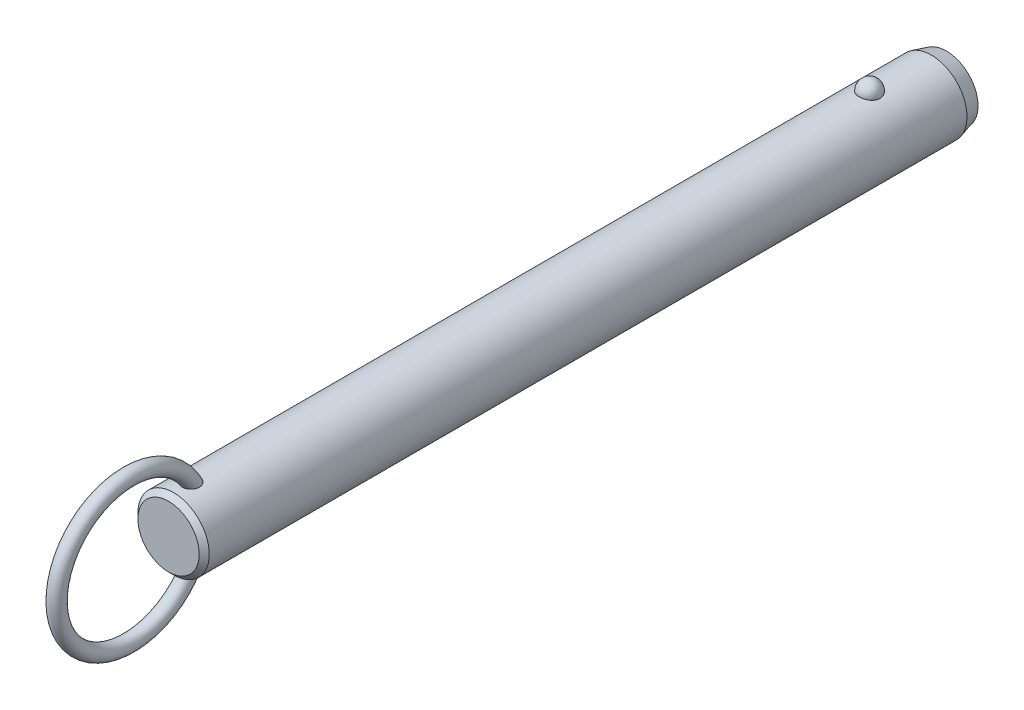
SolidWorks part; units mm, degrees
ref_plane "Front Plane" through (0, 0, 0) normal (0, 0, 1) x (1, 0, 0)
ref_plane "Top Plane" through (0, 0, 0) normal (0, 1, 0) x (1, 0, 0)
ref_plane "Right Plane" through (0, 0, 0) normal (1, 0, 0) x (0, 0, -1)
sketch "Sketch2" plane through (0, 0, 0) normal (0, 0, 1) x (1, 0, 0)
  circle A0 centre (0, 0) radius 7.1
  point P3 (0, 7.1)
  dimension "D1" = 14.2
extrude "Boss-Extrude1" add sketch "Sketch2" along normal blind 129.5
sketch "Sketch3" plane through (0, 0, 0) normal (0, 0, -1) x (-1, 0, 0)
  circle A0 centre (0, 0) radius 7.1
  dimension "D1" = 14.2
extrude "Boss-Extrude2" add sketch "Sketch3" along normal blind 17.4
chamfer "Chamfer1" distance 3 angle 15 1 edges at (-7.1, 0, -17.4)
sketch "Sketch12" plane through (0, 0, 0) normal (1, 0, 0) x (0, 0, -1)
  line L0 (-129.5, 7.1) -> (-129.5, -7.1) construction
  point P0 (-129.5, 0)
sketch "Sketch13" plane through (0, 0, 0) normal (1, 0, 0) x (0, 0, -1)
  circle A0 centre (-145.35, 0) radius 15.85
  point P2 (-129.5, 0)
  dimension "D1" = 31.7
sketch "Sketch14" plane through (0, 0, 0) normal (0, 1, 0) x (1, 0, 0)
  circle A0 centre (0, -131) radius 1.5
  point P2 (0, -129.5)
  dimension "D1" = 3
sweep "Sweep1" add profiles "Sketch14" path "Sketch13"
sketch "Sketch15" plane through (0, 0, 129.5) normal (0, 0, 1) x (1, 0, 0)
  circle A0 centre (0, 0) radius 7.1
  dimension "D1" = 14.2
extrude "Boss-Extrude3" add sketch "Sketch15" along normal blind 7.92
chamfer "Chamfer2" distance 1 angle 45 1 edges at (7.1, 0, 137.42)
sketch "Sketch18" plane through (0, 0, 0) normal (1, 0, 0) x (0, 0, -1)
  line L0 (14.4, 7.1) -> (-131.1792, 7.1) construction
  line L1 (2.1, 9.2) -> (2.1, 5)
  line L2 (-131.1792, -7.1) -> (14.4, -7.1) construction
  arc A0 (2.1, 9.2) -> (2.1, 5) centre (2.1, 7.1) ccw
  point P4 (0, 7.1)
  dimension "D1" = 16.3
revolve "Revolve1" add sketch "Sketch18" angle 360 about L1
